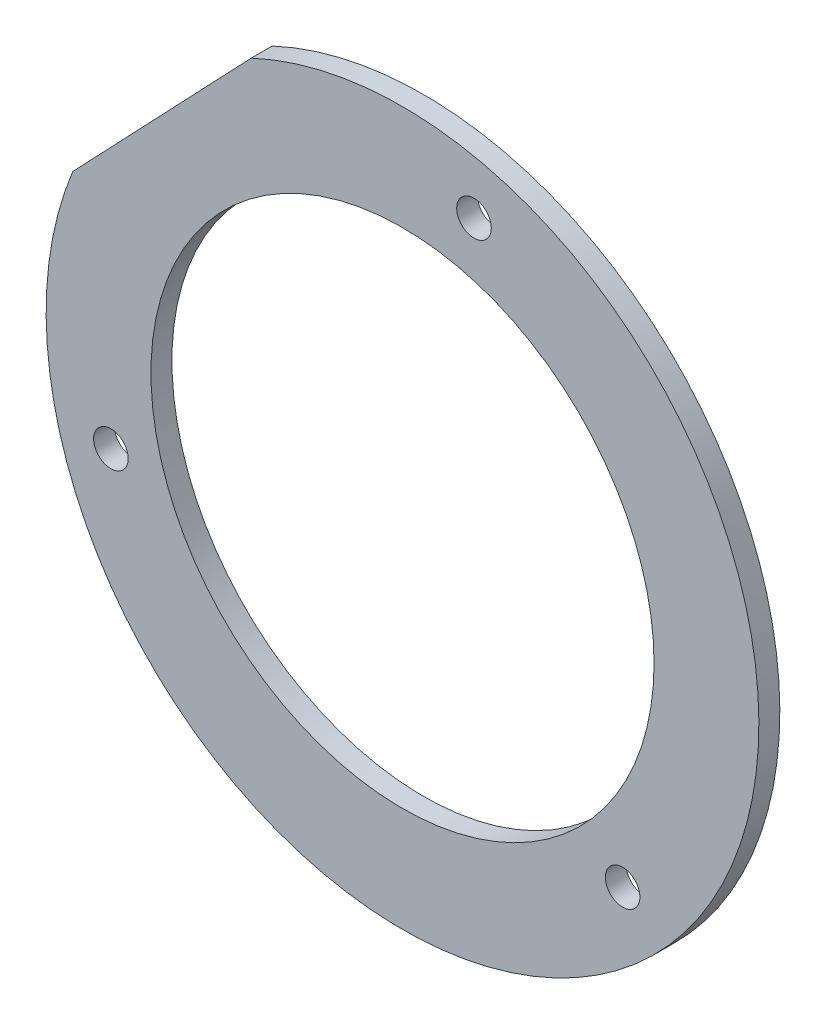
SolidWorks part; units mm, degrees
ref_plane "前视基准面" through (0, 0, 0) normal (0, 0, 1) x (1, 0, 0)
ref_plane "上视基准面" through (0, 0, 0) normal (0, 1, 0) x (1, 0, 0)
ref_plane "右视基准面" through (0, 0, 0) normal (1, 0, 0) x (0, 0, -1)
sketch "草图1" plane through (0, 0, 0) normal (0, 0, 1) x (1, 0, 0)
  line L0 (2.5699, 82.7859) -> (-14.4528, 64.9121)
  line L1 (-0.1979, 81.3297) -> (-13.1333, 67.7476) construction
  arc A0 (-14.4528, 64.9121) -> (2.5699, 82.7859) centre (17, 52) ccw
  circle A1 centre (17, 52) radius 24
  circle A2 centre (17, 52) radius 34 construction
  circle A3 centre (-25, 92) radius 27 construction
  dimension "D1" = 48
  dimension "D2" = 68
  dimension "D3" = 2
extrude "拉伸1" add sketch "草图1" along normal blind 2
hole_wizard "M4 螺纹孔1" positions "草图3" profile "草图2" tap size "M4" standard "ISO"
sketch "草图3" plane through (0, 0, 2) normal (0, 0, 1) x (1, 0, 0)
  circle A1 centre (17, 52) radius 34 construction
  point P1 (23.8205, 80.1865)
  point P4 (-10.8205, 43.8135)
  point P7 (38, 32)
  dimension "D1" = 6.8205
  dimension "D2" = 21
  dimension "D3" = 27.8205
  dimension "D4" = 28.1865
  dimension "D5" = 8.1865
  dimension "D6" = 20
sketch "草图2" plane through (23.8205, 80.1865, 2) normal (1, 0, 0) x (0, -1, 0)
  line L0 (0, 0) -> (0, 2)
  line L1 (0, 2) -> (1.65, 2)
  line L2 (1.65, 2) -> (1.65, 0)
  line L5 (1.65, 0) -> (0, 0)
  line L11 (0, -6.35) -> (0, 107.95) construction
  dimension "籵謂蹟恇謂郰芛眻噤" = 3.3
  dimension "籵謂蹟恇謂郰芛旮僅" = 2
